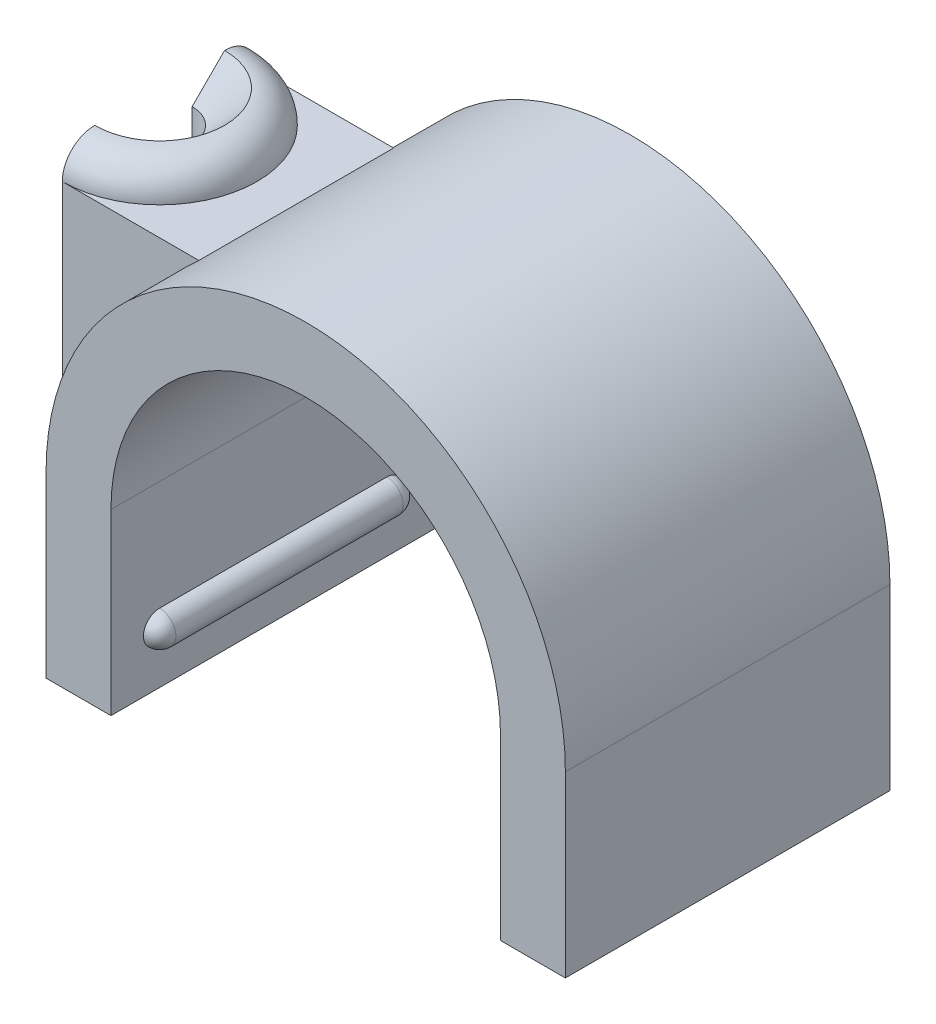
SolidWorks part; units mm, degrees
ref_plane "face" through (0, 0, 0) normal (0, 0, 1) x (1, 0, 0)
ref_plane "dessus" through (0, 0, 0) normal (0, 1, 0) x (1, 0, 0)
ref_plane "profil" through (0, 0, 0) normal (1, 0, 0) x (0, 0, -1)
sketch "Esquisse1" plane through (0, 0, 0) normal (0, 0, 1) x (1, 0, 0)
  line L0 (14, 0) -> (14, 5.5)
  line L1 (2, 0) -> (2, 5.5)
  line L2 (0, 0) -> (0, 5.5)
  line L3 (0, 0) -> (2, 0)
  line L4 (16, 0) -> (16, 5.5)
  line L5 (14, 0) -> (16, 0)
  arc A0 (0, 5.5) -> (16, 5.5) centre (8, 5.5) cw
  arc A1 (2, 5.5) -> (14, 5.5) centre (8, 5.5) cw
  dimension "D4" = 2
  dimension "D3" = 5.5
  dimension "D1" = 16
  dimension "D2" = 5.5
extrude "Base-Extrusion" add sketch "Esquisse1" against normal blind 10
sketch "Esquisse10" plane through (0, 0, 0) normal (0, -1, 0) x (1, 0, 0)
  line L0 (14, 0) -> (2, 0) construction
  line L1 (2, -10) -> (2, 0) construction
  circle A0 centre (-1.5, -5) radius 3
  dimension "D1" = 6
  dimension "D2" = 5
  dimension "D3" = 3.5
extrude "Boss.-Extru.5" add sketch "Esquisse10" against normal blind 12.5
ref_plane "Plan1" through (-1.5, 0, 0) normal (1, 0, 0) x (0, 0, -1)
sketch "Esquisse4" plane through (-1.5, 0, 0) normal (1, 0, 0) x (0, 0, -1)
  line L0 (10, 5.5) -> (10, 0) construction
  line L1 (8, 0) -> (2, 0)
  line L2 (8, 0) -> (8, 11.5)
  line L3 (8, 11.5) -> (2, 11.5)
  line L4 (2, 0) -> (2, 11.5)
  dimension "D1" = 11.5
  dimension "D2" = 6
  dimension "D3" = 2
extrude "Boss.-Extru.3" add sketch "Esquisse4" along normal up to next
ref_plane "Plan2" through (0, 0, -5) normal (0, 0, 1) x (1, 0, 0)
fillet "Congé3" radius 1
hole_wizard "Perçage1" positions "Esquisse12" profile "Esquisse11" countersink size "M2" standard "Ansi Métrique"
sketch "Esquisse12" plane through (0, 12.5, 0) normal (0, 1, 0) x (-1, 0, 0)
  point P0 (1.5, -5)
sketch "Esquisse11" plane through (-1.5, 12.5, -5) normal (1, 0, 0) x (0, 0, 1)
  line L0 (0, 0) -> (0, 12.5)
  line L1 (0, 12.5) -> (1, 12.5)
  line L2 (1, 12.5) -> (1, 1)
  line L3 (1, 1) -> (2, 0)
  line L5 (2, 0) -> (0, 0)
  line L6 (-1, 1) -> (-2, 0) construction
  line L11 (0, -6.35) -> (0, 107.95) construction
  dimension "Diamètre du perçage jusqu'au prochain" = 2
  dimension "Profondeur du perçage jusqu'au prochain" = 12.5
  dimension "Diamètre du fraisage entrant" = 4
  dimension "Angle du fraisage entrant" = 90
sketch "Esquisse9" plane through (0, 0, -5) normal (0, 0, 1) x (1, 0, 0)
  line L4 (2, 0) -> (2, 5.5) construction
  line L6 (2, 2.1191) -> (2, 1.1191)
  arc A0 (2, 1.1191) -> (2, 2.1191) centre (2, 1.6191) ccw
  dimension "D1" = 1
extrude "Boss.-Extru.4" add sketch "Esquisse9" along normal mid plane 8
fillet "Congé5" radius 0.5
ref_plane "Plan3" through (8, 0, 0) normal (-1, 0, 0) x (0, 0, 1)
mirror "Symétrie1" about plane through (8, 0, 0) normal (-1, 0, 0)
sketch "Esquisse13" plane through (-1.5, 0, 0) normal (1, 0, 0) x (0, 0, -1)
  line L1 (-1.2699, 0) -> (11.2699, 0)
  line L2 (-1.2699, 0) -> (-1.2699, 14.299)
  line L3 (-1.2699, 14.299) -> (11.2699, 14.299)
  line L4 (11.2699, 0) -> (11.2699, 14.299)
extrude "Enlèv. mat.-Extru.1" cut sketch "Esquisse13" against normal up to next
